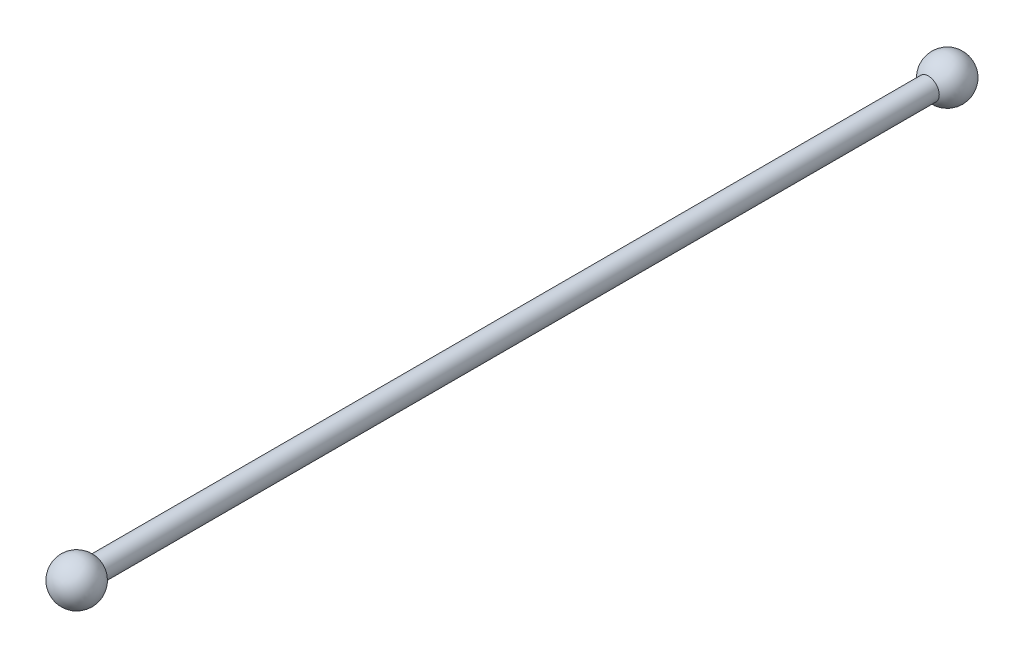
SolidWorks part; units mm, degrees
ref_plane "Front" through (0, 0, 0) normal (0, 0, 1) x (1, 0, 0)
ref_plane "Top" through (0, 0, 0) normal (0, 1, 0) x (1, 0, 0)
ref_plane "Right" through (0, 0, 0) normal (1, 0, 0) x (0, 0, -1)
sketch "Sketch2" plane through (0, 0, 0) normal (0, 0, 1) x (1, 0, 0)
  circle A0 centre (0, 0) radius 25
  dimension "D1" = 50
extrude "Boss-Extrude1" add sketch "Sketch2" along normal mid plane 2000
sketch "Sketch3" plane through (0, 0, 0) normal (0, 1, 0) x (1, 0, 0)
  line L0 (-25, -1000) -> (25, -1000) construction
  line L1 (0, -950) -> (0, -1050)
  arc A0 (0, -1050) -> (0, -950) centre (0, -1000) ccw
  dimension "D1" = 50
revolve "Revolve1" add sketch "Sketch3" angle 360 about L1
mirror "Mirror1" about plane through (0, 0, 0) normal (0, 0, 1) of "Revolve1"
